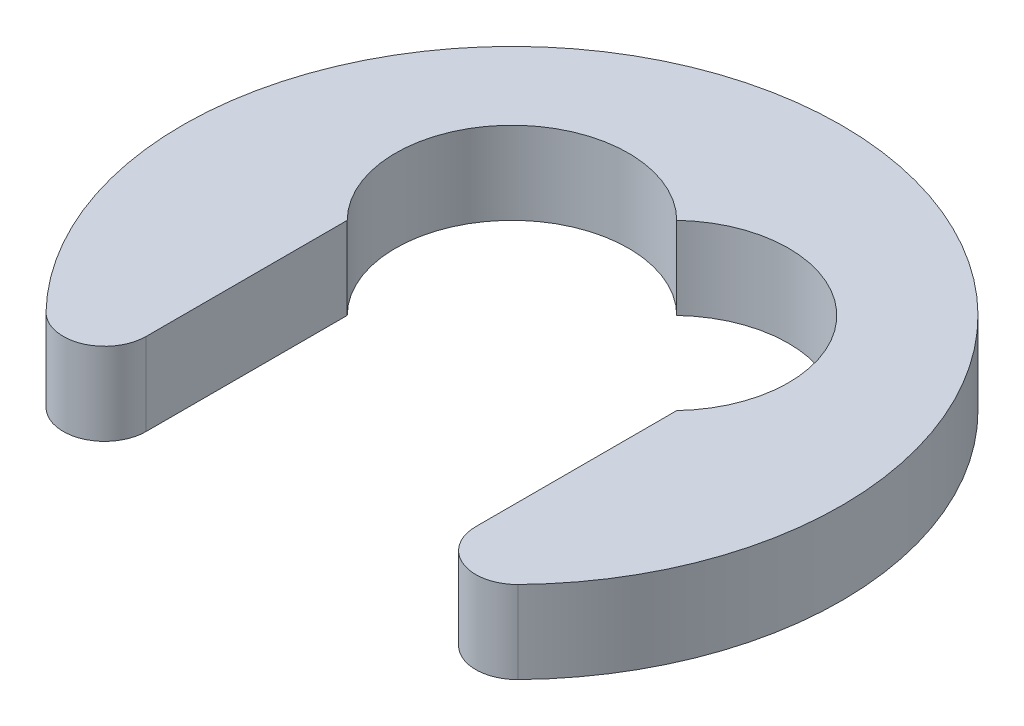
SolidWorks part; units mm, degrees
other "<MirrorClamp.0001>-<<Clamp.0001>-<Imported1>>"
ref_plane "Front Plane" through (0, 0, 0) normal (0, 0, 1) x (1, 0, 0)
ref_plane "Top Plane" through (0, 0, 0) normal (0, 1, 0) x (1, 0, 0)
ref_plane "Right Plane" through (0, 0, 0) normal (1, 0, 0) x (0, 0, -1)
mirrored part "MirrorClamp.0001_Mirrored"
